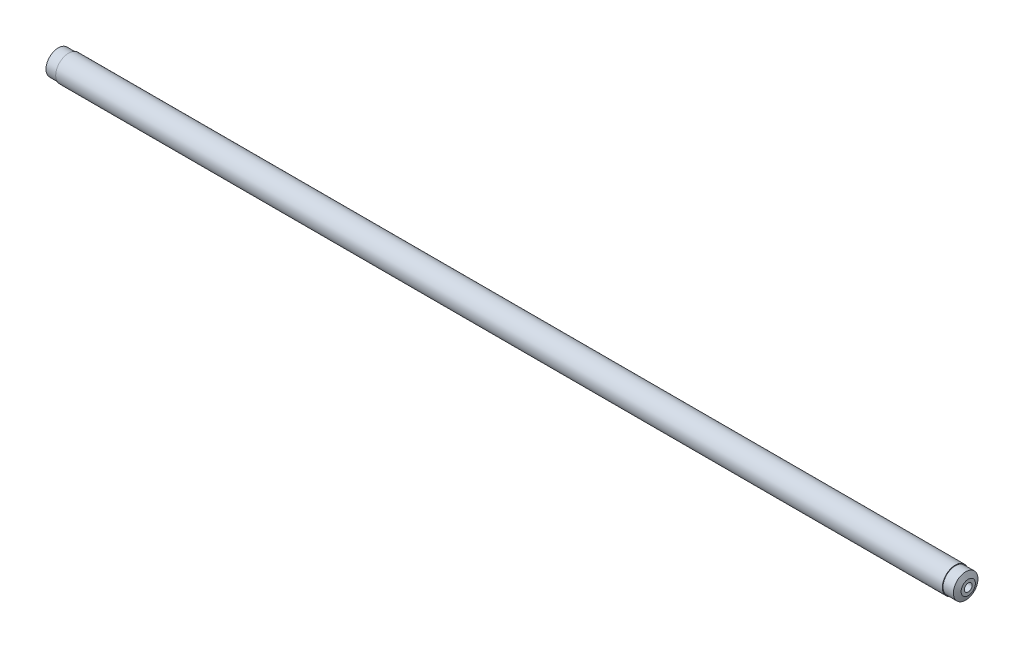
SolidWorks part; units mm, degrees
ref_plane "Plan de face" through (0, 0, 0) normal (0, 0, 1) x (1, 0, 0)
ref_plane "Plan de dessus" through (0, 0, 0) normal (0, 1, 0) x (1, 0, 0)
ref_plane "Plan de droite" through (0, 0, 0) normal (1, 0, 0) x (0, 0, -1)
sketch "Esquisse1" plane through (0, 0, 0) normal (0, 0, 1) x (1, 0, 0)
  line L0 (-342, 10) -> (342, 10)
  line L1 (-350, 9.5) -> (-342, 9.5)
  line L2 (-342, 9.5) -> (-342, 10)
  line L3 (342, 9.5) -> (342, 10)
  line L4 (350, 9.5) -> (342, 9.5)
  line L5 (352, 5.5) -> (350, 9.5)
  line L6 (352, 0) -> (-352, 0)
  line L7 (-352, 0) -> (-352, 5.5)
  line L8 (352, 0) -> (352, 5.5)
  line L10 (0, 0) -> (0, 55.5715) construction
  line L12 (-352, 5.5) -> (-350, 9.5)
  point P18 (0, 10)
  dimension "D1" = 5.5
  dimension "D2" = 2
  dimension "D3" = 10
  dimension "D4" = 9.5
  dimension "D6" = 8
  dimension "D8" = 704
revolve "Révolution1" add sketch "Esquisse1" angle 360 about L6
hole_wizard "Diamètre du perçage M6.0 (6.000000)1" positions "Esquisse3" profile "Esquisse2" hole size "M6.0" standard "ISO"
sketch "Esquisse3" plane through (-352, 0, 0) normal (-1, 0, 0) x (0, 0, 1)
  point P0 (0, 0)
sketch "Esquisse2" plane through (-352, 0, 0) normal (0, 1, 0) x (0, 0, 1)
  line L0 (0, 0) -> (0, 704)
  line L1 (0, 704) -> (3, 704)
  line L2 (3, 704) -> (3, 0)
  line L5 (3, 0) -> (0, 0)
  line L11 (0, -6.35) -> (0, 107.95) construction
  dimension "Diamètre du perçage jusqu'au prochain" = 6
  dimension "Profondeur du perçage jusqu'au prochain" = 704
